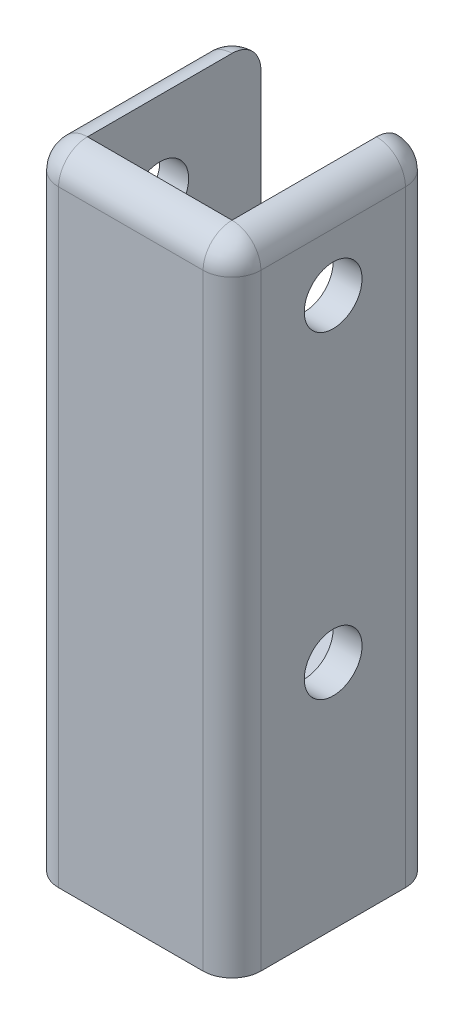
SolidWorks part; units mm, degrees
ref_plane "Front Plane" through (0, 0, 0) normal (0, 0, 1) x (1, 0, 0)
ref_plane "Top Plane" through (0, 0, 0) normal (0, 1, 0) x (1, 0, 0)
ref_plane "Right Plane" through (0, 0, 0) normal (1, 0, 0) x (0, 0, -1)
sketch "Sketch3" plane through (0, 0, 0) normal (0, 1, 0) x (1, 0, 0)
  line L12 (-29.6555, 29.6555) -> (-26.3321, 26.3321) construction
  line L13 (0, 47.1265) -> (0, -41.5159) construction
  line L14 (-50.8618, 0) -> (51.8715, 0) construction
  line L19 (-16.2788, -27.8397) -> (15.1611, -27.8397)
  line L20 (-25, 35) -> (25, 35)
  line L21 (-35, 25) -> (-35, -25)
  line L22 (-25, -35) -> (25, -35)
  line L23 (35, 25) -> (35, -25)
  line L24 (-35, 35) -> (35, -35) construction
  line L25 (-35, -35) -> (35, 35) construction
  line L26 (27.4411, -15.5596) -> (27.4411, 15.8803)
  line L27 (15.1611, 28.1603) -> (-16.2788, 28.1603)
  line L28 (-28.5589, 15.8803) -> (-28.5589, -15.5596)
  arc A16 (25, -35) -> (35, -25) centre (25, -25) ccw
  arc A17 (-25, 35) -> (-35, 25) centre (-25, 25) ccw
  arc A18 (35, 25) -> (25, 35) centre (25, 25) ccw
  arc A19 (-25, -35) -> (-35, -25) centre (-25, -25) cw
  arc A20 (15.1611, -27.8397) -> (17.6484, -25.8141) centre (15.1611, -25.2997) ccw
  arc A21 (25.4156, -18.0469) -> (17.6484, -25.8141) centre (27.4411, -27.8397) ccw
  arc A22 (25.4156, -18.0469) -> (27.4411, -15.5596) centre (24.9011, -15.5596) ccw
  arc A23 (27.4411, 15.8803) -> (25.4156, 18.3676) centre (24.9011, 15.8803) ccw
  arc A24 (17.6484, 26.1348) -> (25.4156, 18.3676) centre (27.4411, 28.1603) ccw
  arc A25 (17.6484, 26.1348) -> (15.1611, 28.1603) centre (15.1611, 25.6203) ccw
  arc A26 (-16.2788, 28.1603) -> (-18.7662, 26.1348) centre (-16.2788, 25.6203) ccw
  arc A27 (-26.5334, 18.3676) -> (-18.7662, 26.1348) centre (-28.5589, 28.1603) ccw
  arc A28 (-26.5334, 18.3676) -> (-28.5589, 15.8803) centre (-26.0189, 15.8803) ccw
  arc A29 (-28.5589, -15.5596) -> (-26.5334, -18.0469) centre (-26.0189, -15.5596) ccw
  arc A30 (-18.7662, -25.8141) -> (-26.5334, -18.0469) centre (-28.5589, -27.8397) ccw
  arc A31 (-18.7662, -25.8141) -> (-16.2788, -27.8397) centre (-16.2788, -25.2997) ccw
  point P0 (0, 0)
  dimension "D3" = 70
  dimension "D5" = 10
  dimension "D6" = 10
  dimension "D1" = 4.7
  dimension "D4" = 70
extrude "Boss-Extrude1" add sketch "Sketch3" along normal blind 50
sketch "Sketch5" plane through (0, 50, 0) normal (0, 1, 0) x (1, 0, 0)
  line L24 (35, -25) -> (35, 25)
  line L25 (25, 35) -> (-25, 35)
  line L26 (-35, 25) -> (-35, -25)
  line L27 (-25, -35) -> (25, -35)
  line L28 (35, -25) -> (35, 25)
  line L29 (25, 35) -> (-25, 35)
  line L30 (-35, 25) -> (-35, -25)
  line L31 (-25, -35) -> (25, -35)
  arc A55 (25, -35) -> (35, -25) centre (25, -25) ccw
  arc A56 (35, 25) -> (25, 35) centre (25, 25) ccw
  arc A57 (-25, 35) -> (-35, 25) centre (-25, 25) ccw
  arc A58 (-35, -25) -> (-25, -35) centre (-25, -25) ccw
  arc A59 (25, -35) -> (35, -25) centre (25, -25) ccw
  arc A60 (35, 25) -> (25, 35) centre (25, 25) ccw
  arc A61 (-25, 35) -> (-35, 25) centre (-25, 25) ccw
  arc A62 (-35, -25) -> (-25, -35) centre (-25, -25) ccw
  dimension "D1" = 0
extrude "Boss-Extrude3" add sketch "Sketch5" along normal blind 5
sketch "Sketch6" plane through (0, 55, 0) normal (0, 1, 0) x (1, 0, 0)
  line L0 (-35, -25) -> (35, -25) construction
  line L1 (-25, 35) -> (-25, -25)
  line L2 (25, 35) -> (25, -25) construction
  line L3 (-25, -25) -> (25, -25)
  line L4 (25, -25) -> (25, 35)
  line L9 (-25, -35) -> (25, -35)
  line L10 (35, -25) -> (35, 25)
  line L11 (25, 35) -> (-25, 35)
  line L12 (-35, 25) -> (-35, -25)
  line L13 (-25, -35) -> (25, -35)
  line L14 (35, -25) -> (35, 25)
  line L16 (-35, 25) -> (-35, -25)
  arc A4 (25, -35) -> (35, -25) centre (25, -25) ccw
  arc A5 (35, 25) -> (25, 35) centre (25, 25) ccw
  arc A6 (-25, 35) -> (-35, 25) centre (-25, 25) ccw
  arc A7 (-35, -25) -> (-25, -35) centre (-25, -25) ccw
  arc A8 (25, -35) -> (35, -25) centre (25, -25) ccw
  arc A9 (35, 25) -> (25, 35) centre (25, 25) ccw
  arc A10 (-25, 35) -> (-35, 25) centre (-25, 25) ccw
  arc A11 (-35, -25) -> (-25, -35) centre (-25, -25) ccw
  dimension "D1" = 0
extrude "Boss-Extrude4" add sketch "Sketch6" along normal blind 165 contours L4 L3 L1 M17 M18 M19 M12 M13 M14 M15
sketch "Sketch7" plane through (-35, 0, 0) normal (-1, 0, 0) x (0, 0, 1)
  line L0 (0, 220) -> (0, 50) construction
  line L1 (-25, 220) -> (25, 220) construction
  circle A0 centre (0, 80) radius 10
  circle A1 centre (0, 190) radius 10
  dimension "D2" = 20
  dimension "D4" = 20
  dimension "D1" = 170
  dimension "D3" = 30
  dimension "D5" = 30
extrude "Cut-Extrude1" cut sketch "Sketch7" against normal blind 100
sketch "Sketch8" plane through (0, 0, 0) normal (0, -1, 0) x (1, 0, 0)
  circle A0 centre (-24.0589, 23.3397) radius 2.5
  circle A1 centre (22.9411, 23.3397) radius 2.5
  circle A2 centre (22.9411, -23.6603) radius 2.5
  circle A3 centre (-24.0589, -23.6603) radius 2.5
extrude "Cut-Extrude2" cut sketch "Sketch8" against normal blind 50
fillet "Fillet1" radius 10 7 edges at (0, 220, 35) (-32.0711, 220, 32.0711) (32.0711, 220, -32.0711) (35, 220, 0) (32.0711, 220, 32.0711) (-32.0711, 220, -32.0711) (-35, 220, 0)
